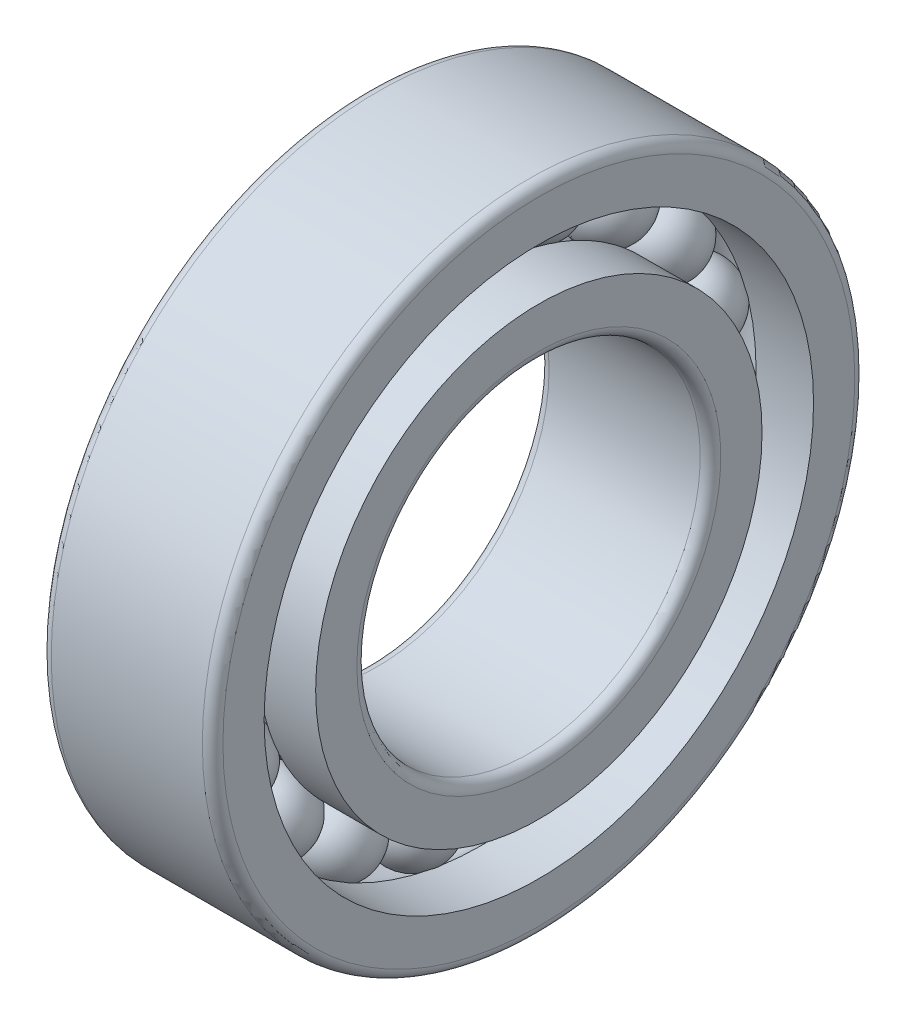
SolidWorks part; units mm, degrees
ref_plane "Front" through (0, 0, 0) normal (0, 0, 1) x (1, 0, 0)
ref_plane "Top" through (0, 0, 0) normal (0, 1, 0) x (1, 0, 0)
ref_plane "Right" through (0, 0, 0) normal (1, 0, 0) x (0, 0, -1)
sketch "Sketch1" plane through (0, 0, 0) normal (0, 0, 1) x (1, 0, 0)
  line L0 (-9.6833, 0) -> (9.8371, 0) construction
  line L1 (-1.125, 7.25) -> (1.125, 7.25)
  line L2 (-4.5966, 7.25) -> (4.6657, 7.25) construction
  arc A0 (1.125, 7.25) -> (-1.125, 7.25) centre (0, 7.25) ccw
revolve "Revolve1" add sketch "Sketch1" angle 360 about L2
sketch "Sketch2" plane through (0, 0, 0) normal (0, 0, 1) x (1, 0, 0)
  line L0 (-2.5, 6.5) -> (-2.5, 5)
  line L1 (-2.5, 5) -> (2.5, 5)
  line L2 (2.5, 5) -> (2.5, 6.5)
  line L3 (2.5, 6.5) -> (0.8251, 6.5)
  line L4 (-6.9714, 0) -> (8.1665, 0) construction
  line L5 (-6.7058, 7.25) -> (6.7058, 7.25) construction
  line L6 (-0.8251, 6.5) -> (-2.5, 6.5)
  arc A0 (-0.8251, 6.5) -> (0.8251, 6.5) centre (0, 7.25) ccw
revolve "Revolve2" add sketch "Sketch2" angle 360 about L4
sketch "Sketch3" plane through (0, 0, 0) normal (0, 0, 1) x (1, 0, 0)
  line L0 (-8.7107, 0) -> (9.1288, 0) construction
  line L1 (-2.5, 9.5) -> (2.5, 9.5)
  line L2 (-2.5, 9.5) -> (-2.5, 8)
  line L3 (-2.5, 8) -> (-0.8251, 8)
  line L4 (2.5, 9.5) -> (2.5, 8)
  line L5 (-7.2948, 7.25) -> (7.2948, 7.25) construction
  line L6 (0.8251, 8) -> (2.5, 8)
  arc A0 (0.8251, 8) -> (-0.8251, 8) centre (0, 7.25) ccw
revolve "Revolve3" add sketch "Sketch3" angle 360 about L0
pattern_circular "Circular-Pattern1" count 19 over 360 about axis through (0, 0, 0) along (1, 0, 0) of "Revolve1"
fillet "Fillet1" radius 0.3 4 edges at (-2.5, 0, 5) (-2.5, 0, 9.5) (2.5, 0, 9.5) (2.5, 0, 5)
equation "\"d0@Sketch1\" = ( \"DD@Sketch3\" + \"d@Sketch2\" )  / 2"
equation "\"dia@Sketch1\" =  ( \"DD@Sketch3\" - \"d@Sketch2\" )  / 4"
equation "\"D3@Sketch2\" = ( \"DD@Sketch3\" + \"d@Sketch2\" )  / 2 / 2"
equation "\"D4@Sketch2\" = ( \"DD@Sketch3\" - \"d@Sketch2\" )  / 6"
equation "\"D5@Sketch2\" = \"dia@Sketch1\" - 0.02"
equation "\"B/2@Sketch2\" = \"B@Sketch2\" / 2"
equation "\"D4@Sketch3\" = ( \"DD@Sketch3\" + \"d@Sketch2\" )  / 2 / 2"
equation "\"D5@Sketch3\" = ( \"DD@Sketch3\" - \"d@Sketch2\" )  / 6"
equation "\"B@Sketch3\" = \"B@Sketch2\""
equation "\"B/2@Sketch3\" = \"B@Sketch3\" / 2"
equation "\"D1@Sketch3\" = \"dia@Sketch1\" - 0.02"
equation "\"m@Circular-Pattern1\" = int( 3.14159265 / atn(( \"dia@Sketch1\" / 2) / sqr(( \"DD@Sketch3\" + \"d@Sketch2\" )  / 2 * ( \"DD@Sketch3\" + \"d@Sketch2\" )  / 2/4 - ( \"dia@Sketch1\" / 2) *  ( \"dia@Sketch1\" / 2))))-1"
